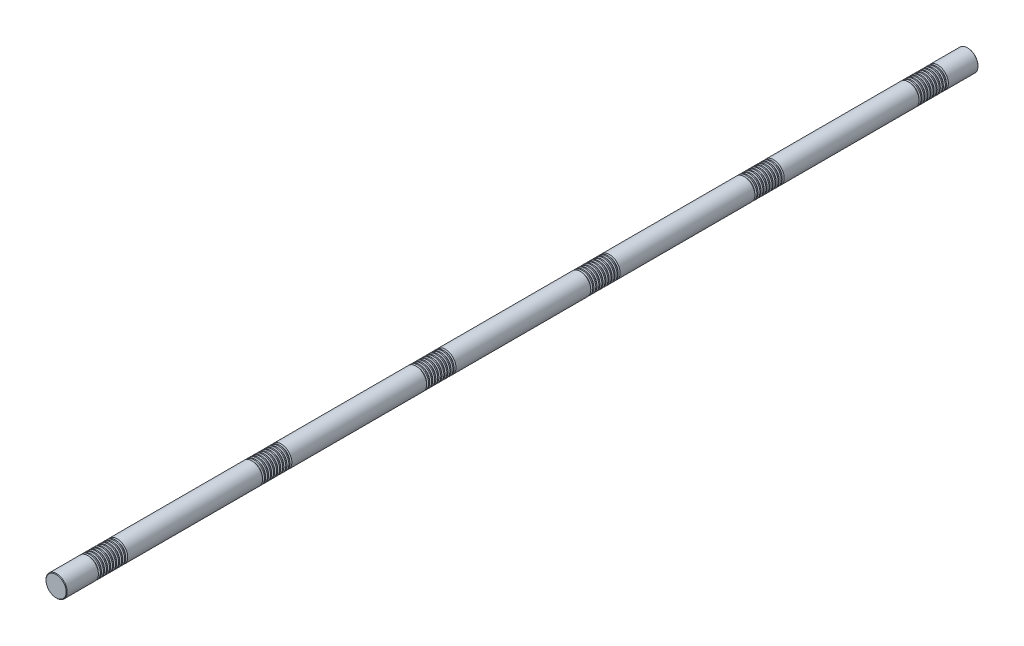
SolidWorks part; units mm, degrees
ref_plane "Front Plane" through (0, 0, 0) normal (0, 0, 1) x (1, 0, 0)
ref_plane "Top Plane" through (0, 0, 0) normal (0, 1, 0) x (1, 0, 0)
ref_plane "Right Plane" through (0, 0, 0) normal (1, 0, 0) x (0, 0, -1)
sketch "Sketch1" plane through (0, 0, 0) normal (0, 0, 1) x (1, 0, 0)
  circle A0 centre (0, 0) radius 35
  dimension "D1" = 70
extrude "Boss-Extrude1" add sketch "Sketch1" along normal mid plane 3000
chamfer "Chamfer1" distance 1.75 angle 45 2 edges at (35, 0, -1500) (35, 0, 1500)
sketch "Sketch2" plane through (0, 0, 0) normal (1, 0, 0) x (0, 0, -1)
  line L0 (1400.7369, 35) -> (1394.2631, 35)
  line L1 (1498.25, 35) -> (-1498.25, 35) construction
  line L2 (1394.2631, 35) -> (1395.7369, 29.5)
  line L3 (1395.7369, 29.5) -> (1399.2631, 29.5)
  line L4 (1399.2631, 29.5) -> (1400.7369, 35)
  line L5 (1500, -33.25) -> (1500, 33.25) construction
  point P4 (1397.5, 35)
  point P7 (1397.5, 29.5)
  point P8 (1400, 32.25)
  point P9 (1395, 32.25)
  dimension "D1" = 5
  dimension "D2" = 100
  dimension "D3" = 5.5
  dimension "D4" = 30
revolve "Cut-Revolve1" cut sketch "Sketch2" angle 360 about axis through (0, 0, 1500) along (0, 0, -1)
pattern_linear "LPattern1" count 10 spacing 10 along (0, 0, 1) of "Cut-Revolve1"
pattern_linear "LPattern2" count 6 spacing 540 along (0, 0, 1) of "Cut-Revolve1", "LPattern1"
